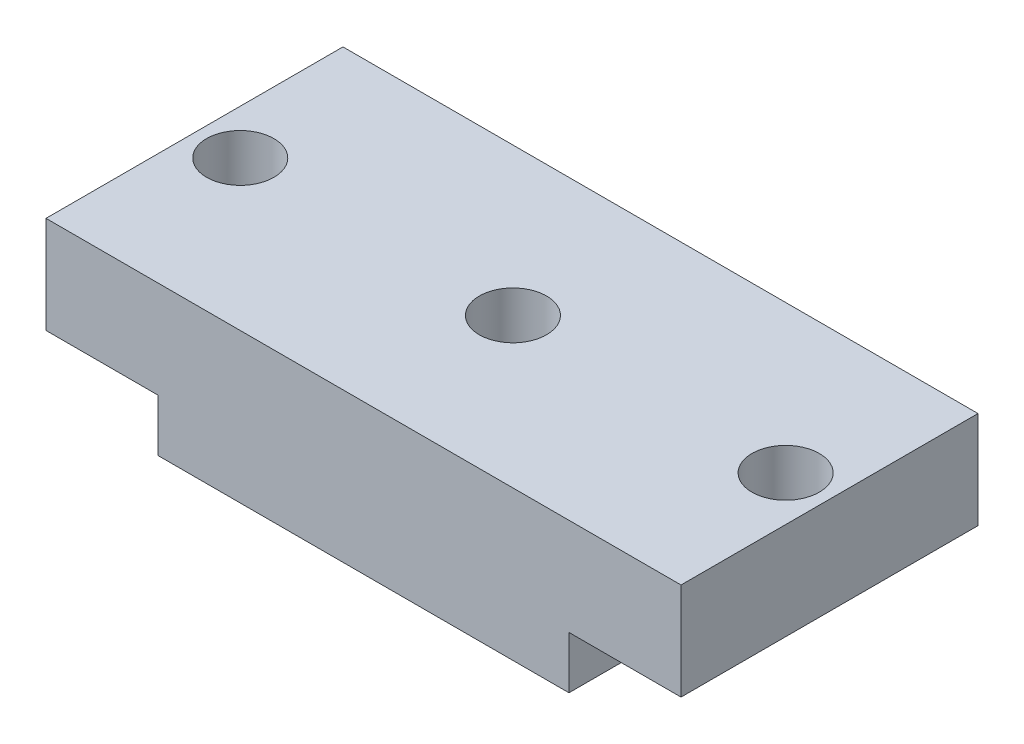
SolidWorks part; units mm, degrees
ref_plane "Face" through (0, 0, 0) normal (0, 0, 1) x (1, 0, 0)
ref_plane "Dessus" through (0, 0, 0) normal (0, 1, 0) x (1, 0, 0)
ref_plane "Droite" through (0, 0, 0) normal (1, 0, 0) x (0, 0, -1)
sketch "Esquisse1" plane through (0, 0, 0) normal (0, 0, 1) x (1, 0, 0)
  line L1 (-97.4839, 36.7807) -> (72.5161, 36.7807)
  line L2 (-97.4839, 36.7807) -> (-97.4839, -3.2193)
  line L3 (-97.4839, -3.2193) -> (72.5161, -3.2193)
  line L4 (72.5161, 36.7807) -> (72.5161, -3.2193)
  dimension "D1" = 170
  dimension "D2" = 40
extrude "Base-Extrusion" add sketch "Esquisse1" along normal blind 60 and the other way blind 19.5
sketch "Esquisse2" plane through (0, 0, 60) normal (0, 0, 1) x (1, 0, 0)
  line L0 (-97.4839, 36.7807) -> (-97.4839, -3.2193) construction
  line L1 (42.5161, 10.7807) -> (72.5161, 10.7807)
  line L2 (42.5161, 10.7807) -> (42.5161, -3.2193)
  line L3 (42.5161, -3.2193) -> (72.5161, -3.2193)
  line L4 (72.5161, 10.7807) -> (72.5161, -3.2193)
  line L5 (-97.4839, 10.7807) -> (-67.4839, 10.7807)
  line L6 (-97.4839, 10.7807) -> (-97.4839, -3.2193)
  line L7 (-97.4839, -3.2193) -> (-67.4839, -3.2193)
  line L8 (-67.4839, 10.7807) -> (-67.4839, -3.2193)
  dimension "D1" = 30
  dimension "D2" = 30
  dimension "D3" = 14
  dimension "D4" = 14
extrude "Enlèv. mat.-Extru.1" cut sketch "Esquisse2" against normal blind 80
hole_wizard "Dégagement M11" positions "Esquisse4" profile "Esquisse3" hole size "M1" standard "ISO"
sketch "Esquisse4" plane through (0, 36.7807, 0) normal (0, 1, 0) x (-1, 0, 0)
  line L0 (-72.5161, 60) -> (-72.5161, -19.5) construction
  line L1 (97.4839, 60) -> (97.4839, -19.5) construction
  line L2 (-72.5161, -19.5) -> (97.4839, -19.5) construction
  point P0 (12.4839, 20)
  point P1 (-60.5161, 20)
  point P2 (85.4839, 20)
  dimension "D1" = 12
  dimension "D2" = 85
  dimension "D3" = 12
  dimension "D4" = 39.5
  dimension "D5" = 39.5
  dimension "D6" = 39.5
sketch "Esquisse3" plane through (-12.4839, 36.7807, 20) normal (1, 0, 0) x (0, 0, 1)
  line L0 (0, 0) -> (0, 45.4077)
  line L1 (0, 45.4077) -> (9, 40)
  line L2 (9, 40) -> (9, 0)
  line L5 (9, 0) -> (0, 0)
  line L10 (0, 45.4077) -> (-9, 40) construction
  line L11 (0, -6.35) -> (0, 107.95) construction
  dimension "Diamètre du perçage" = 18
  dimension "Profondeur du perçage" = 40
  dimension "Angle de pointe" = 118
fillet "Congé1" radius 0.3 1 edges at (-12.4839, -3.2193, -19.5)
